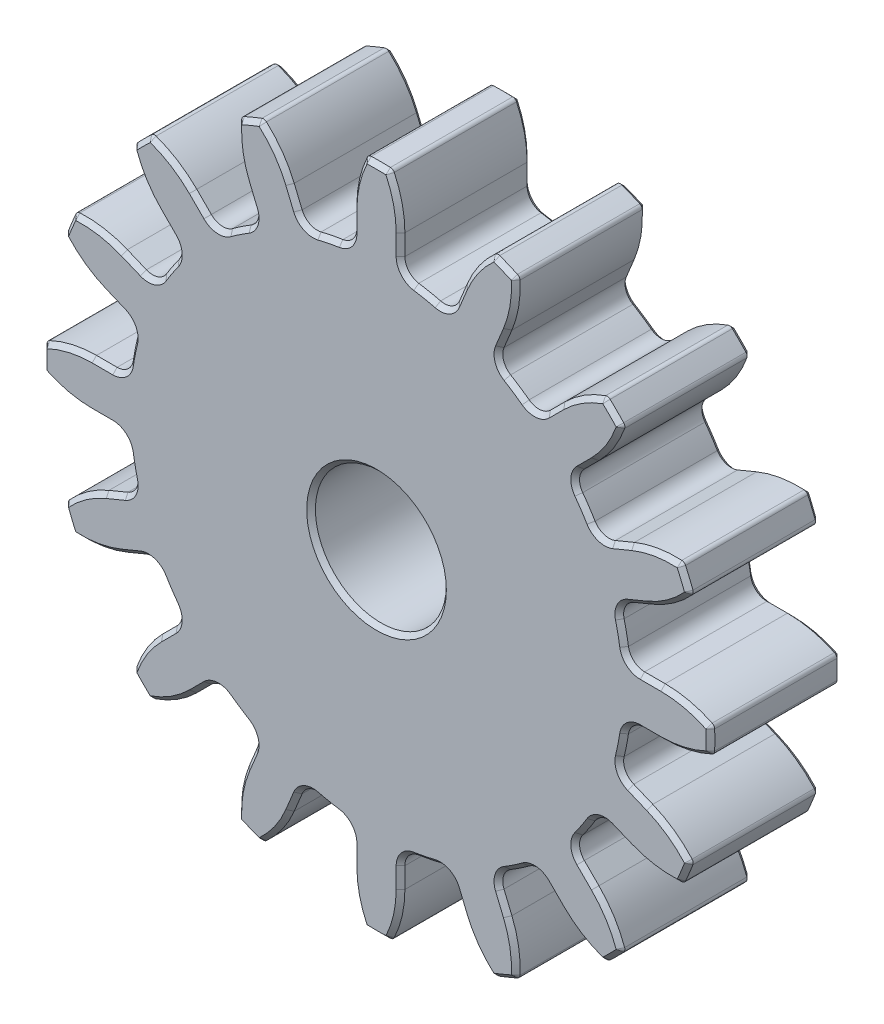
SolidWorks part; units mm, degrees
ref_plane "Спереди" through (0, 0, 0) normal (0, 0, 1) x (1, 0, 0)
ref_plane "Сверху" through (0, 0, 0) normal (0, 1, 0) x (1, 0, 0)
ref_plane "Справа" through (0, 0, 0) normal (1, 0, 0) x (0, 0, -1)
sketch "Эскиз1" plane through (0, 0, 0) normal (0, 0, 1) x (1, 0, 0)
  line L0 (0, 0) -> (0, 15.3) construction
  line L1 (-1.1, 13.0288) -> (-1.1, 12.0842)
  line L2 (1.1, 13.0288) -> (1.1, 12.0842)
  line L3 (3.9696, 12.458) -> (3.6082, 11.5853)
  line L4 (6.0022, 11.6161) -> (5.6407, 10.7434)
  line L5 (8.4349, 9.9906) -> (7.767, 9.3226)
  line L6 (9.9906, 8.4349) -> (9.3226, 7.767)
  line L7 (11.6161, 6.0022) -> (10.7434, 5.6407)
  line L8 (12.458, 3.9696) -> (11.5853, 3.6082)
  line L9 (13.0288, 1.1) -> (12.0842, 1.1)
  line L10 (13.0288, -1.1) -> (12.0842, -1.1)
  line L11 (12.458, -3.9696) -> (11.5853, -3.6082)
  line L12 (11.6161, -6.0022) -> (10.7434, -5.6407)
  line L13 (9.9906, -8.4349) -> (9.3226, -7.767)
  line L14 (8.4349, -9.9906) -> (7.767, -9.3226)
  line L15 (6.0022, -11.6161) -> (5.6407, -10.7434)
  line L16 (3.9696, -12.458) -> (3.6082, -11.5853)
  line L17 (1.1, -13.0288) -> (1.1, -12.0842)
  line L18 (-1.1, -13.0288) -> (-1.1, -12.0842)
  line L19 (-3.9696, -12.458) -> (-3.6082, -11.5853)
  line L20 (-6.0022, -11.6161) -> (-5.6407, -10.7434)
  line L21 (-8.4349, -9.9906) -> (-7.767, -9.3226)
  line L22 (-9.9906, -8.4349) -> (-9.3226, -7.767)
  line L23 (-11.6161, -6.0022) -> (-10.7434, -5.6407)
  line L24 (-12.458, -3.9696) -> (-11.5853, -3.6082)
  line L25 (-13.0288, -1.1) -> (-12.0842, -1.1)
  line L26 (-13.0288, 1.1) -> (-12.0842, 1.1)
  line L27 (-12.458, 3.9696) -> (-11.5853, 3.6082)
  line L28 (-11.6161, 6.0022) -> (-10.7434, 5.6407)
  line L29 (-9.9906, 8.4349) -> (-9.3226, 7.767)
  line L30 (-8.4349, 9.9906) -> (-7.767, 9.3226)
  line L31 (-6.0022, 11.6161) -> (-5.6407, 10.7434)
  line L32 (-3.9696, 12.458) -> (-3.6082, 11.5853)
  circle A0 centre (0, 0) radius 3
  arc A1 (0.4389, 15.2937) -> (-0.4389, 15.2937) centre (0, 0) ccw
  circle A2 centre (0, 0) radius 13.6 construction
  arc A3 (-5.945, 9.8149) -> (-6.7927, 9.2485) centre (0, 0) ccw
  arc A4 (-0.6137, 15.1798) -> (-1.1, 13.0288) centre (3.9, 13.0288) ccw
  arc A5 (0.6137, 15.1798) -> (1.1, 13.0288) centre (-3.9, 13.0288) cw
  arc A6 (0.6137, 15.1798) -> (0.4389, 15.2937) centre (0.4331, 15.0938) ccw
  arc A7 (-0.6137, 15.1798) -> (-0.4389, 15.2937) centre (-0.4331, 15.0938) cw
  arc A8 (5.2421, 14.2592) -> (3.9696, 12.458) centre (8.589, 10.5446) ccw
  arc A9 (5.2421, 14.2592) -> (5.4472, 14.2975) centre (5.376, 14.1106) cw
  arc A10 (6.2581, 13.9616) -> (5.4472, 14.2975) centre (0, 0) ccw
  arc A11 (6.376, 13.7895) -> (6.2581, 13.9616) centre (6.1763, 13.7791) ccw
  arc A12 (6.376, 13.7895) -> (6.0022, 11.6161) centre (1.3828, 13.5295) cw
  arc A13 (10.2998, 11.1677) -> (8.4349, 9.9906) centre (11.9705, 6.455) ccw
  arc A14 (10.2998, 11.1677) -> (10.504, 11.1246) centre (10.3667, 10.9792) cw
  arc A15 (11.1246, 10.504) -> (10.504, 11.1246) centre (0, 0) ccw
  arc A16 (11.1677, 10.2998) -> (11.1246, 10.504) centre (10.9792, 10.3667) ccw
  arc A17 (11.1677, 10.2998) -> (9.9906, 8.4349) centre (6.455, 11.9705) cw
  arc A18 (13.7895, 6.376) -> (11.6161, 6.0022) centre (13.5295, 1.3828) ccw
  arc A19 (13.7895, 6.376) -> (13.9616, 6.2581) centre (13.7791, 6.1763) cw
  arc A20 (14.2975, 5.4472) -> (13.9616, 6.2581) centre (0, 0) ccw
  arc A21 (14.2592, 5.2421) -> (14.2975, 5.4472) centre (14.1106, 5.376) ccw
  arc A22 (14.2592, 5.2421) -> (12.458, 3.9696) centre (10.5446, 8.589) cw
  arc A23 (15.1798, 0.6137) -> (13.0288, 1.1) centre (13.0288, -3.9) ccw
  arc A24 (15.1798, 0.6137) -> (15.2937, 0.4389) centre (15.0938, 0.4331) cw
  arc A25 (15.2937, -0.4389) -> (15.2937, 0.4389) centre (0, 0) ccw
  arc A26 (15.1798, -0.6137) -> (15.2937, -0.4389) centre (15.0938, -0.4331) ccw
  arc A27 (15.1798, -0.6137) -> (13.0288, -1.1) centre (13.0288, 3.9) cw
  arc A28 (14.2592, -5.2421) -> (12.458, -3.9696) centre (10.5446, -8.589) ccw
  arc A29 (14.2592, -5.2421) -> (14.2975, -5.4472) centre (14.1106, -5.376) cw
  arc A30 (13.9616, -6.2581) -> (14.2975, -5.4472) centre (0, 0) ccw
  arc A31 (13.7895, -6.376) -> (13.9616, -6.2581) centre (13.7791, -6.1763) ccw
  arc A32 (13.7895, -6.376) -> (11.6161, -6.0022) centre (13.5295, -1.3828) cw
  arc A33 (11.1677, -10.2998) -> (9.9906, -8.4349) centre (6.455, -11.9705) ccw
  arc A34 (11.1677, -10.2998) -> (11.1246, -10.504) centre (10.9792, -10.3667) cw
  arc A35 (10.504, -11.1246) -> (11.1246, -10.504) centre (0, 0) ccw
  arc A36 (10.2998, -11.1677) -> (10.504, -11.1246) centre (10.3667, -10.9792) ccw
  arc A37 (10.2998, -11.1677) -> (8.4349, -9.9906) centre (11.9705, -6.455) cw
  arc A38 (6.376, -13.7895) -> (6.0022, -11.6161) centre (1.3828, -13.5295) ccw
  arc A39 (6.376, -13.7895) -> (6.2581, -13.9616) centre (6.1763, -13.7791) cw
  arc A40 (5.4472, -14.2975) -> (6.2581, -13.9616) centre (0, 0) ccw
  arc A41 (5.2421, -14.2592) -> (5.4472, -14.2975) centre (5.376, -14.1106) ccw
  arc A42 (5.2421, -14.2592) -> (3.9696, -12.458) centre (8.589, -10.5446) cw
  arc A43 (0.6137, -15.1798) -> (1.1, -13.0288) centre (-3.9, -13.0288) ccw
  arc A44 (0.6137, -15.1798) -> (0.4389, -15.2937) centre (0.4331, -15.0938) cw
  arc A45 (-0.4389, -15.2937) -> (0.4389, -15.2937) centre (0, 0) ccw
  arc A46 (-0.6137, -15.1798) -> (-0.4389, -15.2937) centre (-0.4331, -15.0938) ccw
  arc A47 (-0.6137, -15.1798) -> (-1.1, -13.0288) centre (3.9, -13.0288) cw
  arc A48 (-5.2421, -14.2592) -> (-3.9696, -12.458) centre (-8.589, -10.5446) ccw
  arc A49 (-5.2421, -14.2592) -> (-5.4472, -14.2975) centre (-5.376, -14.1106) cw
  arc A50 (-6.2581, -13.9616) -> (-5.4472, -14.2975) centre (0, 0) ccw
  arc A51 (-6.376, -13.7895) -> (-6.2581, -13.9616) centre (-6.1763, -13.7791) ccw
  arc A52 (-6.376, -13.7895) -> (-6.0022, -11.6161) centre (-1.3828, -13.5295) cw
  arc A53 (-10.2998, -11.1677) -> (-8.4349, -9.9906) centre (-11.9705, -6.455) ccw
  arc A54 (-10.2998, -11.1677) -> (-10.504, -11.1246) centre (-10.3667, -10.9792) cw
  arc A55 (-11.1246, -10.504) -> (-10.504, -11.1246) centre (0, 0) ccw
  arc A56 (-11.1677, -10.2998) -> (-11.1246, -10.504) centre (-10.9792, -10.3667) ccw
  arc A57 (-11.1677, -10.2998) -> (-9.9906, -8.4349) centre (-6.455, -11.9705) cw
  arc A58 (-13.7895, -6.376) -> (-11.6161, -6.0022) centre (-13.5295, -1.3828) ccw
  arc A59 (-13.7895, -6.376) -> (-13.9616, -6.2581) centre (-13.7791, -6.1763) cw
  arc A60 (-14.2975, -5.4472) -> (-13.9616, -6.2581) centre (0, 0) ccw
  arc A61 (-14.2592, -5.2421) -> (-14.2975, -5.4472) centre (-14.1106, -5.376) ccw
  arc A62 (-14.2592, -5.2421) -> (-12.458, -3.9696) centre (-10.5446, -8.589) cw
  arc A63 (-15.1798, -0.6137) -> (-13.0288, -1.1) centre (-13.0288, 3.9) ccw
  arc A64 (-15.1798, -0.6137) -> (-15.2937, -0.4389) centre (-15.0938, -0.4331) cw
  arc A65 (-15.2937, 0.4389) -> (-15.2937, -0.4389) centre (0, 0) ccw
  arc A66 (-15.1798, 0.6137) -> (-15.2937, 0.4389) centre (-15.0938, 0.4331) ccw
  arc A67 (-15.1798, 0.6137) -> (-13.0288, 1.1) centre (-13.0288, -3.9) cw
  arc A68 (-14.2592, 5.2421) -> (-12.458, 3.9696) centre (-10.5446, 8.589) ccw
  arc A69 (-14.2592, 5.2421) -> (-14.2975, 5.4472) centre (-14.1106, 5.376) cw
  arc A70 (-13.9616, 6.2581) -> (-14.2975, 5.4472) centre (0, 0) ccw
  arc A71 (-13.7895, 6.376) -> (-13.9616, 6.2581) centre (-13.7791, 6.1763) ccw
  arc A72 (-13.7895, 6.376) -> (-11.6161, 6.0022) centre (-13.5295, 1.3828) cw
  arc A73 (-11.1677, 10.2998) -> (-9.9906, 8.4349) centre (-6.455, 11.9705) ccw
  arc A74 (-11.1677, 10.2998) -> (-11.1246, 10.504) centre (-10.9792, 10.3667) cw
  arc A75 (-10.504, 11.1246) -> (-11.1246, 10.504) centre (0, 0) ccw
  arc A76 (-10.2998, 11.1677) -> (-10.504, 11.1246) centre (-10.3667, 10.9792) ccw
  arc A77 (-10.2998, 11.1677) -> (-8.4349, 9.9906) centre (-11.9705, 6.455) cw
  arc A78 (-6.376, 13.7895) -> (-6.0022, 11.6161) centre (-1.3828, 13.5295) ccw
  arc A79 (-6.376, 13.7895) -> (-6.2581, 13.9616) centre (-6.1763, 13.7791) cw
  arc A80 (-5.4472, 14.2975) -> (-6.2581, 13.9616) centre (0, 0) ccw
  arc A81 (-5.2421, 14.2592) -> (-5.4472, 14.2975) centre (-5.376, 14.1106) ccw
  arc A82 (-5.2421, 14.2592) -> (-3.9696, 12.458) centre (-8.589, 10.5446) cw
  arc A83 (-9.2485, 6.7927) -> (-9.8149, 5.945) centre (0, 0) ccw
  arc A84 (-11.144, 2.7364) -> (-11.3428, 1.7365) centre (0, 0) ccw
  arc A85 (-1.7365, 11.3428) -> (-2.7364, 11.144) centre (0, 0) ccw
  arc A86 (2.7364, 11.144) -> (1.7365, 11.3428) centre (0, 0) ccw
  arc A87 (6.7927, 9.2485) -> (5.945, 9.8149) centre (0, 0) ccw
  arc A88 (9.8149, 5.945) -> (9.2485, 6.7927) centre (0, 0) ccw
  arc A89 (11.3428, 1.7365) -> (11.144, 2.7364) centre (0, 0) ccw
  arc A90 (11.144, -2.7364) -> (11.3428, -1.7365) centre (0, 0) ccw
  arc A91 (9.2485, -6.7927) -> (9.8149, -5.945) centre (0, 0) ccw
  arc A92 (5.945, -9.8149) -> (6.7927, -9.2485) centre (0, 0) ccw
  arc A93 (1.7365, -11.3428) -> (2.7364, -11.144) centre (0, 0) ccw
  arc A94 (-2.7364, -11.144) -> (-1.7365, -11.3428) centre (0, 0) ccw
  arc A95 (-6.7927, -9.2485) -> (-5.945, -9.8149) centre (0, 0) ccw
  arc A96 (-9.8149, -5.945) -> (-9.2485, -6.7927) centre (0, 0) ccw
  arc A97 (-11.3428, -1.7365) -> (-11.144, -2.7364) centre (0, 0) ccw
  arc A98 (7.767, -9.3226) -> (6.7927, -9.2485) centre (7.2367, -9.853) ccw
  arc A99 (5.6407, -10.7434) -> (5.945, -9.8149) centre (6.3336, -10.4564) cw
  arc A100 (3.6082, -11.5853) -> (2.7364, -11.144) centre (2.9152, -11.8723) ccw
  arc A101 (1.1, -12.0842) -> (1.7365, -11.3428) centre (1.85, -12.0842) cw
  arc A102 (-1.1, -12.0842) -> (-1.7365, -11.3428) centre (-1.85, -12.0842) ccw
  arc A103 (-3.6082, -11.5853) -> (-2.7364, -11.144) centre (-2.9152, -11.8723) cw
  arc A104 (-5.6407, -10.7434) -> (-5.945, -9.8149) centre (-6.3336, -10.4564) ccw
  arc A105 (-7.767, -9.3226) -> (-6.7927, -9.2485) centre (-7.2367, -9.853) cw
  arc A106 (-9.3226, -7.767) -> (-9.2485, -6.7927) centre (-9.853, -7.2367) ccw
  arc A107 (-10.7434, -5.6407) -> (-9.8149, -5.945) centre (-10.4564, -6.3336) cw
  arc A108 (-11.5853, -3.6082) -> (-11.144, -2.7364) centre (-11.8723, -2.9152) ccw
  arc A109 (-12.0842, -1.1) -> (-11.3428, -1.7365) centre (-12.0842, -1.85) cw
  arc A110 (-12.0842, 1.1) -> (-11.3428, 1.7365) centre (-12.0842, 1.85) ccw
  arc A111 (-11.5853, 3.6082) -> (-11.144, 2.7364) centre (-11.8723, 2.9152) cw
  arc A112 (-10.7434, 5.6407) -> (-9.8149, 5.945) centre (-10.4564, 6.3336) ccw
  arc A113 (-9.3226, 7.767) -> (-9.2485, 6.7927) centre (-9.853, 7.2367) cw
  arc A114 (9.3226, -7.767) -> (9.2485, -6.7927) centre (9.853, -7.2367) cw
  arc A115 (10.7434, -5.6407) -> (9.8149, -5.945) centre (10.4564, -6.3336) ccw
  arc A116 (11.5853, -3.6082) -> (11.144, -2.7364) centre (11.8723, -2.9152) cw
  arc A117 (12.0842, -1.1) -> (11.3428, -1.7365) centre (12.0842, -1.85) ccw
  arc A118 (12.0842, 1.1) -> (11.3428, 1.7365) centre (12.0842, 1.85) cw
  arc A119 (11.5853, 3.6082) -> (11.144, 2.7364) centre (11.8723, 2.9152) ccw
  arc A120 (10.7434, 5.6407) -> (9.8149, 5.945) centre (10.4564, 6.3336) cw
  arc A121 (9.3226, 7.767) -> (9.2485, 6.7927) centre (9.853, 7.2367) ccw
  arc A122 (7.767, 9.3226) -> (6.7927, 9.2485) centre (7.2367, 9.853) cw
  arc A123 (5.6407, 10.7434) -> (5.945, 9.8149) centre (6.3336, 10.4564) ccw
  arc A124 (3.6082, 11.5853) -> (2.7364, 11.144) centre (2.9152, 11.8723) cw
  arc A125 (1.1, 12.0842) -> (1.7365, 11.3428) centre (1.85, 12.0842) ccw
  arc A126 (-1.1, 12.0842) -> (-1.7365, 11.3428) centre (-1.85, 12.0842) cw
  arc A127 (-3.6082, 11.5853) -> (-2.7364, 11.144) centre (-2.9152, 11.8723) ccw
  arc A128 (-5.6407, 10.7434) -> (-5.945, 9.8149) centre (-6.3336, 10.4564) cw
  arc A129 (-7.767, 9.3226) -> (-6.7927, 9.2485) centre (-7.2367, 9.853) ccw
  point P16 (0.5596, 15.2898)
  point P19 (-0.5596, 15.2898)
  point P270 (1.1, 11.4222)
  point P273 (-1.1, 11.4222)
  dimension "D1" = 6
  dimension "D2" = 30.6
  dimension "D3" = 27.2
  dimension "D4" = 22.95
  dimension "D6" = 10
  dimension "D7" = 0.2
  dimension "D9" = 0.75
  dimension "D5" = 2.2
  dimension "D8" = 16
extrude "Бобышка-Вытянуть1" add sketch "Эскиз1" along normal blind 6
chamfer "Фаска1" distance 0.2 angle 45 322 edges at (3, 0, 0) (0, 15.3, 0) (-0.5423, 15.2614, 0) (-0.9769, 14.1315, 0) (-1.1, 12.5565, 0) (-1.281, 11.5957, 0) (-2.2387, 11.2545, 0) (-3.254, 11.2032, 0) (-3.7889, 12.0217, 0) (-4.5053, 13.4296, 0) (-5.3393, 14.3072, 0) (-5.8551, 14.1354, 0) (-6.3413, 13.8921, 0) (-6.3104, 12.6819, 0) (-5.8214, 11.1798, 0) (-5.6209, 10.2228, 0) (-6.3752, 9.5411, 0) (-7.2936, 9.1051, 0) (-8.101, 9.6566, 0) (-9.3017, 10.6832, 0) (-10.408, 11.1749, 0) (-10.8187, 10.8187, 0) (-11.1749, 10.408, 0) (-10.6832, 9.3017, 0) (-9.6566, 8.101, 0) (-9.1051, 7.2936, 0) (-9.5411, 6.3752, 0) (-10.2228, 5.6209, 0) (-11.1798, 5.8214, 0) (-12.6819, 6.3104, 0) (-13.8921, 6.3413, 0) (-14.1354, 5.8551, 0) (-14.3072, 5.3393, 0) (-13.4296, 4.5053, 0) (-12.0217, 3.7889, 0) (-11.2032, 3.254, 0) (-11.2545, 2.2387, 0) (-11.5957, 1.281, 0) (-12.5565, 1.1, 0) (-14.1315, 0.9769, 0) (-15.2614, 0.5423, 0) (-15.3, 0, 0) (-15.2614, -0.5423, 0) (-14.1315, -0.9769, 0) (-12.5565, -1.1, 0) (-11.5957, -1.281, 0) (-11.2545, -2.2387, 0) (-11.2032, -3.254, 0) (-12.0217, -3.7889, 0) (-13.4296, -4.5053, 0) (-14.3072, -5.3393, 0) (-14.1354, -5.8551, 0) (-13.8921, -6.3413, 0) (-12.6819, -6.3104, 0) (-11.1798, -5.8214, 0) (-10.2228, -5.6209, 0) (-9.5411, -6.3752, 0) (-9.1051, -7.2936, 0) (-9.6566, -8.101, 0) (-10.6832, -9.3017, 0) (-11.1749, -10.408, 0) (-10.8187, -10.8187, 0) (-10.408, -11.1749, 0) (-9.3017, -10.6832, 0) (-8.101, -9.6566, 0) (-7.2936, -9.1051, 0) (-6.3752, -9.5411, 0) (-5.6209, -10.2228, 0) (-5.8214, -11.1798, 0) (-6.3104, -12.6819, 0) (-6.3413, -13.8921, 0) (-5.8551, -14.1354, 0) (-5.3393, -14.3072, 0) (-4.5053, -13.4296, 0) (-3.7889, -12.0217, 0) (-3.254, -11.2032, 0) (-2.2387, -11.2545, 0) (-1.281, -11.5957, 0) (-1.1, -12.5565, 0) (-0.9769, -14.1315, 0) (-0.5423, -15.2614, 0) (0, -15.3, 0) (0.5423, -15.2614, 0) (0.9769, -14.1315, 0) (1.1, -12.5565, 0) (1.281, -11.5957, 0) (2.2387, -11.2545, 0) (3.254, -11.2032, 0) (3.7889, -12.0217, 0) (4.5053, -13.4296, 0) (5.3393, -14.3072, 0) (5.8551, -14.1354, 0) (6.3413, -13.8921, 0) (6.3104, -12.6819, 0) (5.8214, -11.1798, 0) (5.6209, -10.2228, 0) (6.3752, -9.5411, 0) (7.2936, -9.1051, 0) (8.101, -9.6566, 0) (9.3017, -10.6832, 0) (10.408, -11.1749, 0) (10.8187, -10.8187, 0) (11.1749, -10.408, 0) (10.6832, -9.3017, 0) (9.6566, -8.101, 0) (9.1051, -7.2936, 0) (9.5411, -6.3752, 0) (10.2228, -5.6209, 0) (11.1798, -5.8214, 0) (12.6819, -6.3104, 0) (13.8921, -6.3413, 0) (14.1354, -5.8551, 0) (14.3072, -5.3393, 0) (13.4296, -4.5053, 0) (12.0217, -3.7889, 0) (11.2032, -3.254, 0) (11.2545, -2.2387, 0) (11.5957, -1.281, 0) (12.5565, -1.1, 0) (14.1315, -0.9769, 0) (15.2614, -0.5423, 0) (15.3, 0, 0) (15.2614, 0.5423, 0) (14.1315, 0.9769, 0) (12.5565, 1.1, 0) (11.5957, 1.281, 0) (11.2545, 2.2387, 0) (11.2032, 3.254, 0) (12.0217, 3.7889, 0) (13.4296, 4.5053, 0) (14.3072, 5.3393, 0) (14.1354, 5.8551, 0) (13.8921, 6.3413, 0) (12.6819, 6.3104, 0) (11.1798, 5.8214, 0) (10.2228, 5.6209, 0) (9.5411, 6.3752, 0) (9.1051, 7.2936, 0) (9.6566, 8.101, 0) (10.6832, 9.3017, 0) (11.1749, 10.408, 0) (10.8187, 10.8187, 0) (10.408, 11.1749, 0) (9.3017, 10.6832, 0) (8.101, 9.6566, 0) (7.2936, 9.1051, 0) (6.3752, 9.5411, 0) (5.6209, 10.2228, 0) (5.8214, 11.1798, 0) (6.3104, 12.6819, 0) (6.3413, 13.8921, 0) (5.8551, 14.1354, 0) (5.3393, 14.3072, 0) (4.5053, 13.4296, 0) (3.7889, 12.0217, 0) (3.254, 11.2032, 0) (2.2387, 11.2545, 0) (1.281, 11.5957, 0) (1.1, 12.5565, 0) (0.9769, 14.1315, 0) (0.5423, 15.2614, 0) (3, 0, 6) (0.9769, 14.1315, 6) (1.1, 12.5565, 6) (1.281, 11.5957, 6) (2.2387, 11.2545, 6) (3.254, 11.2032, 6) (3.7889, 12.0217, 6) (4.5053, 13.4296, 6) (5.3393, 14.3072, 6) (5.8551, 14.1354, 6) (6.3413, 13.8921, 6) (6.3104, 12.6819, 6) (5.8214, 11.1798, 6) (5.6209, 10.2228, 6) (6.3752, 9.5411, 6) (7.2936, 9.1051, 6) (8.101, 9.6566, 6) (9.3017, 10.6832, 6) (10.408, 11.1749, 6) (10.8187, 10.8187, 6) (11.1749, 10.408, 6) (10.6832, 9.3017, 6) (9.6566, 8.101, 6) (9.1051, 7.2936, 6) (9.5411, 6.3752, 6) (10.2228, 5.6209, 6) (11.1798, 5.8214, 6) (12.6819, 6.3104, 6) (13.8921, 6.3413, 6) (14.1354, 5.8551, 6) (14.3072, 5.3393, 6) (13.4296, 4.5053, 6) (12.0217, 3.7889, 6) (11.2032, 3.254, 6) (11.2545, 2.2387, 6) (11.5957, 1.281, 6) (12.5565, 1.1, 6) (14.1315, 0.9769, 6) (15.2614, 0.5423, 6) (15.3, 0, 6) (15.2614, -0.5423, 6) (14.1315, -0.9769, 6) (12.5565, -1.1, 6) (11.5957, -1.281, 6) (11.2545, -2.2387, 6) (11.2032, -3.254, 6) (12.0217, -3.7889, 6) (13.4296, -4.5053, 6) (14.3072, -5.3393, 6) (14.1354, -5.8551, 6) (13.8921, -6.3413, 6) (12.6819, -6.3104, 6) (11.1798, -5.8214, 6) (10.2228, -5.6209, 6) (9.5411, -6.3752, 6) (9.1051, -7.2936, 6) (9.6566, -8.101, 6) (10.6832, -9.3017, 6) (11.1749, -10.408, 6) (10.8187, -10.8187, 6) (10.408, -11.1749, 6) (9.3017, -10.6832, 6) (8.101, -9.6566, 6) (7.2936, -9.1051, 6) (6.3752, -9.5411, 6) (5.6209, -10.2228, 6) (5.8214, -11.1798, 6) (6.3104, -12.6819, 6) (6.3413, -13.8921, 6) (5.8551, -14.1354, 6) (5.3393, -14.3072, 6) (4.5053, -13.4296, 6) (3.7889, -12.0217, 6) (3.254, -11.2032, 6) (2.2387, -11.2545, 6) (1.281, -11.5957, 6) (1.1, -12.5565, 6) (0.9769, -14.1315, 6) (0.5423, -15.2614, 6) (0, -15.3, 6) (-0.5423, -15.2614, 6) (-0.9769, -14.1315, 6) (-1.1, -12.5565, 6) (-1.281, -11.5957, 6) (-2.2387, -11.2545, 6) (-3.254, -11.2032, 6) (-3.7889, -12.0217, 6) (-4.5053, -13.4296, 6) (-5.3393, -14.3072, 6) (-5.8551, -14.1354, 6) (-6.3413, -13.8921, 6) (-6.3104, -12.6819, 6) (-5.8214, -11.1798, 6) (-5.6209, -10.2228, 6) (-6.3752, -9.5411, 6) (-7.2936, -9.1051, 6) (-8.101, -9.6566, 6) (-9.3017, -10.6832, 6) (-10.408, -11.1749, 6) (-10.8187, -10.8187, 6) (-11.1749, -10.408, 6) (-10.6832, -9.3017, 6) (-9.6566, -8.101, 6) (-9.1051, -7.2936, 6) (-9.5411, -6.3752, 6) (-10.2228, -5.6209, 6) (-11.1798, -5.8214, 6) (-12.6819, -6.3104, 6) (-13.8921, -6.3413, 6) (-14.1354, -5.8551, 6) (-14.3072, -5.3393, 6) (-13.4296, -4.5053, 6) (-12.0217, -3.7889, 6) (-11.2032, -3.254, 6) (-11.2545, -2.2387, 6) (-11.5957, -1.281, 6) (-12.5565, -1.1, 6) (-14.1315, -0.9769, 6) (-15.2614, -0.5423, 6) (-15.3, 0, 6) (-15.2614, 0.5423, 6) (-14.1315, 0.9769, 6) (-12.5565, 1.1, 6) (-11.5957, 1.281, 6) (-11.2545, 2.2387, 6) (-11.2032, 3.254, 6) (-12.0217, 3.7889, 6) (-13.4296, 4.5053, 6) (-14.3072, 5.3393, 6) (-14.1354, 5.8551, 6) (-13.8921, 6.3413, 6) (-12.6819, 6.3104, 6) (-11.1798, 5.8214, 6) (-10.2228, 5.6209, 6) (-9.5411, 6.3752, 6) (-9.1051, 7.2936, 6) (-9.6566, 8.101, 6) (-10.6832, 9.3017, 6) (-11.1749, 10.408, 6) (-10.8187, 10.8187, 6) (-10.408, 11.1749, 6) (-9.3017, 10.6832, 6) (-8.101, 9.6566, 6) (-7.2936, 9.1051, 6) (-6.3752, 9.5411, 6) (-5.6209, 10.2228, 6) (-5.8214, 11.1798, 6) (-6.3104, 12.6819, 6) (-6.3413, 13.8921, 6) (-5.8551, 14.1354, 6) (-5.3393, 14.3072, 6) (-4.5053, 13.4296, 6) (-3.7889, 12.0217, 6) (-3.254, 11.2032, 6) (-2.2387, 11.2545, 6) (-1.281, 11.5957, 6) (-1.1, 12.5565, 6) (-0.9769, 14.1315, 6) (-0.5423, 15.2614, 6) (0, 15.3, 6) (0.5423, 15.2614, 6)
